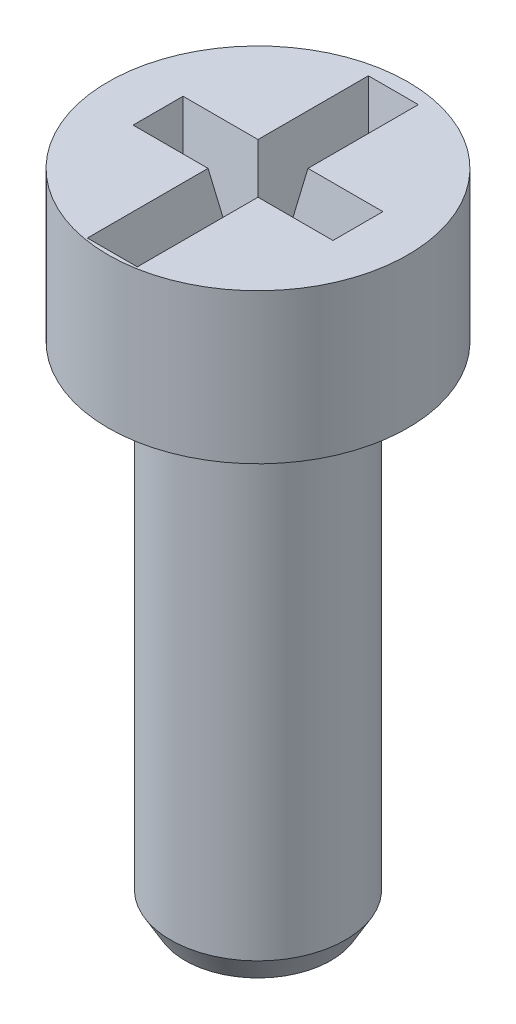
SolidWorks part; units mm, degrees
ref_plane "Plan de face" through (0, 0, 0) normal (0, 0, 1) x (1, 0, 0)
ref_plane "Plan de dessus" through (0, 0, 0) normal (0, 1, 0) x (1, 0, 0)
ref_plane "Plan de droite" through (0, 0, 0) normal (1, 0, 0) x (0, 0, -1)
sketch "Esquisse1" plane through (0, 0, 0) normal (0, 0, 1) x (1, 0, 0)
  line L0 (0, 0) -> (0, 10.8618) construction
  line L1 (0, 0) -> (1.75, 0)
  line L2 (1.75, 0) -> (1.75, 10)
  line L3 (1.75, 10) -> (3, 10)
  line L4 (3, 10) -> (3, 13)
  line L5 (3, 13) -> (0, 13)
  line L6 (0, 0) -> (0, 13)
  dimension "D1" = 3.5
  dimension "D2" = 6
  dimension "D3" = 3
  dimension "D4" = 10
revolve "Révolution1" add sketch "Esquisse1" angle 360 about L0
chamfer "Chanfrein1" distance 0.5 angle 30 1 edges at (0, 0, -1.75)
sketch "Esquisse2" plane through (0, 13, 0) normal (0, 1, 0) x (-1, 0, 0)
  line L0 (0, 0) -> (0, 1.1352) construction
  line L1 (-0.5, -2.709) -> (0.5, -2.709)
  line L2 (-0.5, -2.709) -> (-0.5, -0.5)
  line L3 (-0.5, 2.9154) -> (0.5, 2.9154)
  line L4 (0.5, -2.709) -> (0.5, -0.5)
  line L5 (0, 0) -> (-0.8213, 0) construction
  line L6 (-2, -0.5) -> (-0.5, -0.5)
  line L7 (-2, -0.5) -> (-2, 0.5)
  line L8 (-2, 0.5) -> (-0.5, 0.5)
  line L9 (2, -0.5) -> (2, 0.5)
  line L10 (-0.5, 0.5) -> (-0.5, 2.9154)
  line L11 (0.5, 0.5) -> (2, 0.5)
  line L12 (0.5, 0.5) -> (0.5, 2.9154)
  line L13 (0.5, -0.5) -> (2, -0.5)
  dimension "D1" = 1
  dimension "D2" = 1
  dimension "D3" = 4
extrude "Enlèv. mat.-Extru.1" cut sketch "Esquisse2" against normal blind 1.5 draft 10
